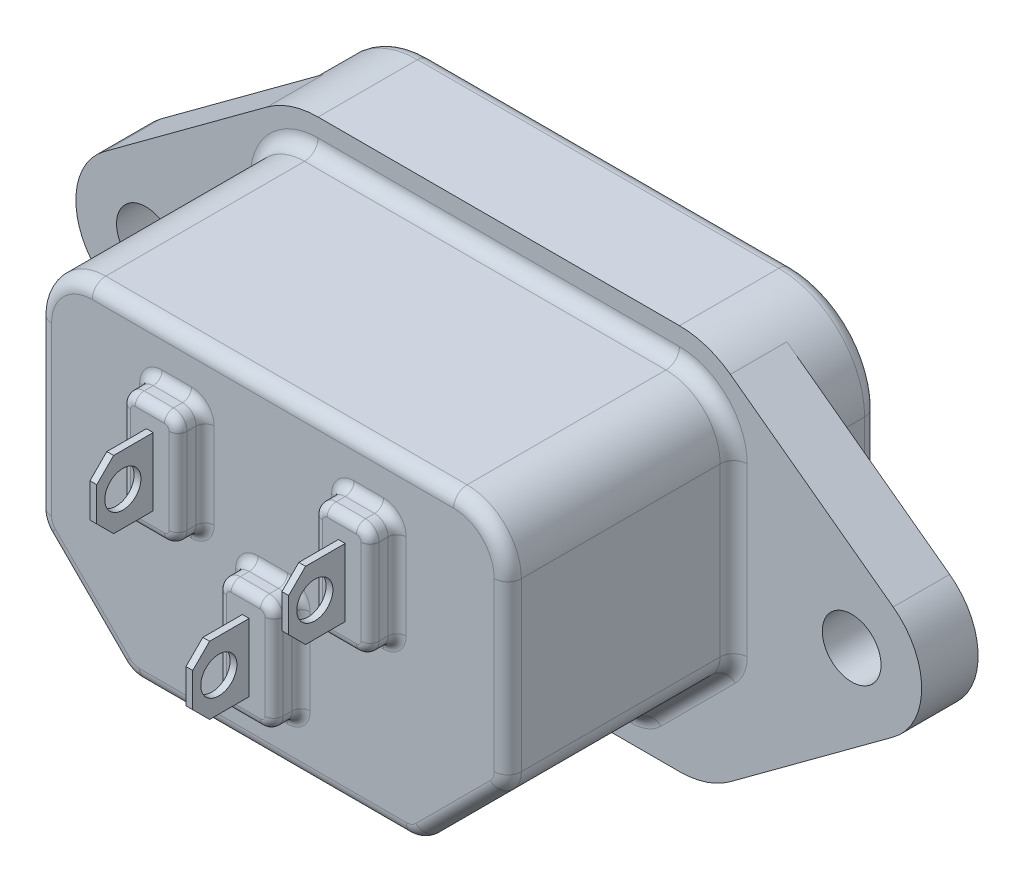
SolidWorks part; units mm, degrees
ref_plane "Front" through (0, 0, 0) normal (0, 0, 1) x (1, 0, 0)
ref_plane "Top" through (0, 0, 0) normal (0, 1, 0) x (1, 0, 0)
ref_plane "Side" through (0, 0, 0) normal (1, 0, 0) x (0, 0, -1)
sketch "Sketch1" plane through (0, 0, 0) normal (0, 0, 1) x (1, 0, 0)
  line L8 (-54.229, 34.671) -> (-33.909, 34.671)
  line L9 (-59.055, 17.78) -> (-59.055, 29.845)
  line L10 (-54.229, 12.954) -> (-33.909, 12.954)
  line L11 (-29.083, 17.78) -> (-29.083, 29.845)
  arc A8 (-54.229, 34.671) -> (-59.055, 29.845) centre (-54.229, 29.845) ccw
  arc A9 (-59.055, 17.78) -> (-54.229, 12.954) centre (-54.229, 17.78) ccw
  arc A10 (-33.909, 12.954) -> (-29.083, 17.78) centre (-33.909, 17.78) ccw
  arc A11 (-29.083, 29.845) -> (-33.909, 34.671) centre (-33.909, 29.845) ccw
extrude "Base-Extrude" add sketch "Sketch1" against normal blind 3.175
sketch "Sketch2" plane through (0, 0, 0) normal (0, 0, 1) x (1, 0, 0)
  line L2 (-54.229, 12.954) -> (-33.909, 12.954)
  line L3 (-54.229, 34.671) -> (-33.909, 34.671)
  line L4 (-57.0922, 33.7299) -> (-66.2485, 26.9818)
  line L5 (-66.2485, 20.6432) -> (-57.0922, 13.8951)
  line L6 (-31.0458, 13.8951) -> (-21.8895, 20.6432)
  line L7 (-31.0458, 33.7299) -> (-21.8895, 26.9818)
  arc A4 (-66.2485, 26.9818) -> (-66.2485, 20.6432) centre (-63.9128, 23.8125) ccw
  arc A5 (-21.8895, 20.6432) -> (-21.8895, 26.9818) centre (-24.2252, 23.8125) ccw
  circle A7 centre (-63.9128, 23.8125) radius 1.651
  circle A8 centre (-24.2252, 23.8125) radius 1.651
  arc A13 (-33.909, 12.954) -> (-31.0458, 13.8951) centre (-33.909, 17.78) ccw
  arc A14 (-57.0922, 13.8951) -> (-54.229, 12.954) centre (-54.229, 17.78) ccw
  arc A15 (-54.229, 34.671) -> (-57.0922, 33.7299) centre (-54.229, 29.845) ccw
  arc A16 (-31.0458, 33.7299) -> (-33.909, 34.671) centre (-33.909, 29.845) ccw
extrude "Boss-Extrude1" add sketch "Sketch2" along normal blind 3.175
sketch "Sketch3" plane through (0, 0, 3.175) normal (0, 0, 1) x (1, 0, 0)
  line L0 (-30.861, 19.812) -> (-35.941, 14.732)
  line L1 (-57.277, 19.812) -> (-52.197, 14.732)
  line L4 (-54.229, 32.893) -> (-33.909, 32.893)
  line L5 (-30.861, 29.845) -> (-30.861, 17.78)
  line L6 (-33.909, 14.732) -> (-54.229, 14.732)
  line L7 (-57.277, 17.78) -> (-57.277, 29.845)
  line L8 (-54.229, 32.893) -> (-33.909, 32.893)
  line L9 (-30.861, 29.845) -> (-30.861, 19.812)
  line L10 (-35.941, 14.732) -> (-52.197, 14.732)
  line L11 (-57.277, 19.812) -> (-57.277, 29.845)
  arc A4 (-54.229, 32.893) -> (-57.277, 29.845) centre (-54.229, 29.845) ccw
  arc A5 (-30.861, 29.845) -> (-33.909, 32.893) centre (-33.909, 29.845) ccw
  arc A6 (-33.909, 14.732) -> (-30.861, 17.78) centre (-33.909, 17.78) ccw
  arc A7 (-57.277, 17.78) -> (-54.229, 14.732) centre (-54.229, 17.78) ccw
  arc A8 (-54.229, 32.893) -> (-57.277, 29.845) centre (-54.229, 29.845) ccw
  arc A9 (-30.861, 29.845) -> (-33.909, 32.893) centre (-33.909, 29.845) ccw
  dimension "D2" = 45
  dimension "D3" = 45
  dimension "D4" = 5.08
  dimension "D1" = 1.778
extrude "Boss-Extrude2" add sketch "Sketch3" along normal blind 12.7
fillet "Fillet1" radius 1.524 4 edges at (-57.277, 19.812, 9.525) (-52.197, 14.732, 9.525) (-35.941, 14.732, 9.525) (-30.861, 19.812, 9.525)
fillet "Fillet2" radius 0.762 12 edges at (-56.3843, 32.0003, 3.175) (-31.7537, 32.0003, 3.175) (-44.069, 32.893, 3.175) (-30.861, 25.1441, 3.175) (-33.401, 17.272, 3.175) (-44.069, 14.732, 3.175) (-54.737, 17.272, 3.175) (-57.277, 25.1441, 3.175) (-30.977, 19.8601, 3.175) (-35.9891, 14.848, 3.175) (-52.1489, 14.848, 3.175) (-57.161, 19.8601, 3.175)
fillet "Fillet3" radius 0.762 20 edges at (-57.6415, 14.3675, -3.175) (-44.069, 12.954, -3.175) (-30.4965, 14.3675, -3.175) (-29.083, 23.8125, -3.175) (-30.4965, 33.2575, -3.175) (-44.069, 34.671, -3.175) (-57.6415, 33.2575, -3.175) (-30.861, 25.1441, 15.875) (-59.055, 23.8125, -3.175) (-44.069, 32.893, 15.875) (-56.3843, 32.0003, 15.875) (-31.7537, 32.0003, 15.875) (-33.401, 17.272, 15.875) (-57.277, 25.1441, 15.875) (-54.737, 17.272, 15.875) (-44.069, 14.732, 15.875) (-57.161, 19.8601, 15.875) (-52.1489, 14.848, 15.875) (-35.9891, 14.848, 15.875) (-30.977, 19.8601, 15.875)
sketch "Sketch4" plane through (0, 0, -3.175) normal (0, 0, -1) x (-1, 0, 0)
  line L6 (55.499, 20.5485) -> (51.4605, 16.51)
  line L7 (51.4605, 16.51) -> (36.6775, 16.51)
  line L8 (36.6775, 16.51) -> (32.639, 20.5485)
  line L9 (32.639, 20.5485) -> (32.639, 29.845)
  line L10 (33.909, 31.115) -> (54.229, 31.115)
  line L11 (55.499, 29.845) -> (55.499, 20.5485)
  line L12 (55.499, 20.5485) -> (51.4605, 16.51)
  line L13 (51.4605, 16.51) -> (36.6775, 16.51)
  line L14 (36.6775, 16.51) -> (32.639, 20.5485)
  line L15 (32.639, 20.5485) -> (32.639, 29.845)
  line L16 (33.909, 31.115) -> (54.229, 31.115)
  line L17 (55.499, 29.845) -> (55.499, 20.5485)
  arc A6 (33.909, 31.115) -> (32.639, 29.845) centre (33.909, 29.845) ccw
  arc A7 (55.499, 29.845) -> (54.229, 31.115) centre (54.229, 29.845) ccw
  arc A8 (33.909, 31.115) -> (32.639, 29.845) centre (33.909, 29.845) ccw
  arc A9 (55.499, 29.845) -> (54.229, 31.115) centre (54.229, 29.845) ccw
  dimension "D1" = 1.016
extrude "Cut-Extrude1" cut sketch "Sketch4" against normal blind 16.891
fillet "Fillet4" radius 0.762 12 edges at (-55.499, 20.5485, 5.2705) (-51.4605, 16.51, 5.2705) (-36.6775, 16.51, 5.2705) (-32.639, 20.5485, 5.2705) (-33.011, 30.743, 13.716) (-55.127, 30.743, 13.716) (-55.499, 25.1967, 13.716) (-53.4798, 18.5292, 13.716) (-44.069, 16.51, 13.716) (-34.6582, 18.5292, 13.716) (-32.639, 25.1967, 13.716) (-44.069, 31.115, 13.716)
fillet "Fillet5" radius 0.762 12 edges at (-55.499, 25.3546, -3.175) (-44.069, 31.115, -3.175) (-55.127, 30.743, -3.175) (-33.011, 30.743, -3.175) (-34.6582, 18.5292, -3.175) (-32.639, 25.3546, -3.175) (-44.069, 16.51, -3.175) (-53.4798, 18.5292, -3.175) (-32.697, 20.5725, -3.175) (-36.7015, 16.568, -3.175) (-51.4365, 16.568, -3.175) (-55.441, 20.5725, -3.175)
sketch "Sketch5" plane through (0, 0, 15.875) normal (0, 0, 1) x (1, 0, 0)
  line L0 (-44.069, 34.671) -> (-44.069, 12.954) construction
  line L2 (-50.292, 30.1625) -> (-48.641, 30.1625)
  line L3 (-51.054, 29.4005) -> (-51.054, 24.5745)
  line L4 (-48.641, 23.8125) -> (-50.292, 23.8125)
  line L5 (-47.879, 24.5745) -> (-47.879, 29.4005)
  line L6 (-37.846, 30.1625) -> (-39.497, 30.1625)
  line L7 (-37.084, 29.4005) -> (-37.084, 24.5745)
  line L8 (-39.497, 23.8125) -> (-37.846, 23.8125)
  line L9 (-40.259, 24.5745) -> (-40.259, 29.4005)
  line L10 (-43.2435, 23.8125) -> (-44.8945, 23.8125)
  line L11 (-45.6565, 23.0505) -> (-45.6565, 18.2245)
  line L12 (-42.4815, 23.0505) -> (-42.4815, 18.2245)
  line L13 (-44.8945, 17.4625) -> (-43.2435, 17.4625)
  line L15 (-54.229, 34.671) -> (-33.909, 34.671) construction
  line L16 (-54.229, 12.954) -> (-33.909, 12.954) construction
  arc A0 (-43.2435, 17.4625) -> (-42.4815, 18.2245) centre (-43.2435, 18.2245) ccw
  arc A1 (-44.8945, 17.4625) -> (-45.6565, 18.2245) centre (-44.8945, 18.2245) cw
  arc A2 (-43.2435, 23.8125) -> (-42.4815, 23.0505) centre (-43.2435, 23.0505) cw
  arc A3 (-45.6565, 23.0505) -> (-44.8945, 23.8125) centre (-44.8945, 23.0505) cw
  arc A4 (-47.879, 24.5745) -> (-48.641, 23.8125) centre (-48.641, 24.5745) cw
  arc A5 (-50.292, 23.8125) -> (-51.054, 24.5745) centre (-50.292, 24.5745) cw
  arc A6 (-47.879, 29.4005) -> (-48.641, 30.1625) centre (-48.641, 29.4005) ccw
  arc A7 (-51.054, 29.4005) -> (-50.292, 30.1625) centre (-50.292, 29.4005) cw
  arc A8 (-40.259, 24.5745) -> (-39.497, 23.8125) centre (-39.497, 24.5745) ccw
  arc A9 (-37.846, 23.8125) -> (-37.084, 24.5745) centre (-37.846, 24.5745) ccw
  arc A10 (-37.084, 29.4005) -> (-37.846, 30.1625) centre (-37.846, 29.4005) ccw
  arc A11 (-40.259, 29.4005) -> (-39.497, 30.1625) centre (-39.497, 29.4005) cw
  point P15 (-44.069, 23.8125)
  point P18 (-44.069, 17.2085)
  point P22 (-42.4815, 17.2085)
  point P27 (-42.4815, 23.8125)
  point P32 (-47.879, 23.8125)
  point P35 (-51.054, 23.8125)
  point P38 (-47.879, 28.8925)
  point P41 (-51.054, 28.8925)
  dimension "D3" = 0.762
  dimension "D1" = 3.175
  dimension "D2" = 6.35
extrude "Boss-Extrude3" add sketch "Sketch5" along normal blind 1.524
fillet "Fillet6" radius 0.508 48 edges at (-42.7047, 17.6857, 15.875) (-42.4815, 20.6375, 17.399) (-42.7047, 23.5893, 17.399) (-44.069, 23.8125, 15.875) (-45.4333, 23.5893, 17.399) (-45.6565, 20.6375, 15.875) (-45.4333, 17.6857, 17.399) (-44.069, 17.4625, 15.875) (-42.7047, 17.6857, 17.399) (-44.069, 23.8125, 17.399) (-45.6565, 20.6375, 17.399) (-44.069, 17.4625, 17.399) (-45.4333, 17.6857, 15.875) (-45.4333, 23.5893, 15.875) (-42.7047, 23.5893, 15.875) (-42.4815, 20.6375, 15.875) (-48.1022, 24.0357, 17.399) (-47.879, 26.9875, 15.875) (-48.1022, 29.9393, 15.875) (-49.4665, 30.1625, 17.399) (-50.8308, 29.9393, 17.399) (-51.054, 26.9875, 15.875) (-50.8308, 24.0357, 17.399) (-49.4665, 23.8125, 17.399) (-47.879, 26.9875, 17.399) (-48.1022, 29.9393, 17.399) (-51.054, 26.9875, 17.399) (-48.1022, 24.0357, 15.875) (-49.4665, 23.8125, 15.875) (-50.8308, 24.0357, 15.875) (-50.8308, 29.9393, 15.875) (-49.4665, 30.1625, 15.875) (-40.0358, 24.0357, 15.875) (-38.6715, 23.8125, 15.875) (-37.3072, 24.0357, 15.875) (-37.084, 26.9875, 17.399) (-37.3072, 29.9393, 15.875) (-38.6715, 30.1625, 15.875) (-40.0358, 29.9393, 17.399) (-40.259, 26.9875, 17.399) (-40.0358, 24.0357, 17.399) (-38.6715, 23.8125, 17.399) (-37.3072, 24.0357, 17.399) (-37.3072, 29.9393, 17.399) (-38.6715, 30.1625, 17.399) (-40.259, 26.9875, 15.875) (-40.0358, 29.9393, 15.875) (-37.084, 26.9875, 15.875)
sketch "Sketch6" plane through (0, 0, 17.399) normal (0, 0, 1) x (1, 0, 0)
  line L0 (-44.069, 34.671) -> (-44.069, 12.954) construction
  line L1 (-54.229, 34.671) -> (-33.909, 34.671) construction
  line L2 (-54.229, 12.954) -> (-33.909, 12.954) construction
  line L3 (-39.624, 28.8925) -> (-37.719, 28.8925)
  line L4 (-39.624, 28.8925) -> (-39.624, 25.0825)
  line L5 (-37.719, 25.0825) -> (-39.624, 25.0825)
  line L6 (-37.719, 25.0825) -> (-37.719, 28.8925)
  line L7 (-48.514, 28.8925) -> (-50.419, 28.8925)
  line L8 (-48.514, 28.8925) -> (-48.514, 25.0825)
  line L9 (-50.419, 25.0825) -> (-48.514, 25.0825)
  line L10 (-50.419, 25.0825) -> (-50.419, 28.8925)
  line L11 (-43.1165, 22.5425) -> (-45.0215, 22.5425)
  line L12 (-45.0215, 22.5425) -> (-45.0215, 18.7325)
  line L13 (-43.1165, 22.5425) -> (-43.1165, 18.7325)
  line L14 (-45.0215, 18.7325) -> (-43.1165, 18.7325)
  line L15 (-39.497, 30.1625) -> (-37.846, 30.1625) construction
  line L16 (-44.8945, 23.8125) -> (-43.2435, 23.8125) construction
  line L17 (-40.259, 24.5745) -> (-40.259, 29.4005) construction
  point P17 (-44.069, 22.5425)
  point P20 (-44.069, 18.7325)
  dimension "D1" = 3.81
  dimension "D2" = 1.905
  dimension "D3" = 1.27
  dimension "D4" = 1.27
  dimension "D5" = 0.635
extrude "Boss-Extrude4" add sketch "Sketch6" along normal blind 3.175 and the other way offset from surface (19.05 mm away) 1.524
sketch "Sketch7" plane through (0, 0, 20.574) normal (0, 0, 1) x (1, 0, 0)
  line L0 (-43.8785, 17.9705) -> (-43.2435, 17.9705)
  line L1 (-38.862, 28.8925) -> (-38.862, 25.0825)
  line L2 (-38.862, 29.6545) -> (-38.862, 24.3205)
  line L3 (-49.657, 25.0825) -> (-49.657, 28.8925)
  line L4 (-49.657, 24.3205) -> (-49.657, 29.6545)
  line L5 (-44.2595, 22.5425) -> (-44.2595, 18.7325)
  line L6 (-44.2595, 23.3045) -> (-44.2595, 17.9705)
  line L7 (-43.8785, 22.5425) -> (-43.8785, 18.7325)
  line L8 (-43.8785, 23.3045) -> (-43.8785, 17.9705)
  line L9 (-38.481, 25.0825) -> (-38.481, 28.8925)
  line L10 (-38.481, 24.3205) -> (-38.481, 29.6545)
  line L11 (-49.276, 28.8925) -> (-49.276, 25.0825)
  line L12 (-49.276, 29.6545) -> (-49.276, 24.3205)
  line L13 (-44.2595, 23.3045) -> (-44.8945, 23.3045)
  line L14 (-38.862, 29.6545) -> (-39.497, 29.6545)
  line L15 (-38.481, 24.3205) -> (-37.846, 24.3205)
  line L16 (-45.1485, 23.0505) -> (-45.1485, 18.2245)
  line L17 (-44.8945, 17.9705) -> (-43.2435, 17.9705)
  line L18 (-42.9895, 18.2245) -> (-42.9895, 23.0505)
  line L19 (-43.2435, 23.3045) -> (-44.8945, 23.3045)
  line L20 (-45.1485, 23.0505) -> (-45.1485, 18.2245)
  line L21 (-44.8945, 17.9705) -> (-44.2595, 17.9705)
  line L22 (-42.9895, 18.2245) -> (-42.9895, 23.0505)
  line L23 (-43.2435, 23.3045) -> (-43.8785, 23.3045)
  line L24 (-39.751, 29.4005) -> (-39.751, 24.5745)
  line L25 (-39.497, 24.3205) -> (-37.846, 24.3205)
  line L26 (-37.592, 24.5745) -> (-37.592, 29.4005)
  line L27 (-37.846, 29.6545) -> (-39.497, 29.6545)
  line L28 (-39.751, 29.4005) -> (-39.751, 24.5745)
  line L29 (-39.497, 24.3205) -> (-38.862, 24.3205)
  line L30 (-37.592, 24.5745) -> (-37.592, 29.4005)
  line L31 (-37.846, 29.6545) -> (-38.481, 29.6545)
  line L32 (-50.546, 29.4005) -> (-50.546, 24.5745)
  line L33 (-50.292, 24.3205) -> (-48.641, 24.3205)
  line L34 (-48.387, 24.5745) -> (-48.387, 29.4005)
  line L35 (-48.641, 29.6545) -> (-50.292, 29.6545)
  line L36 (-50.546, 29.4005) -> (-50.546, 24.5745)
  line L37 (-50.292, 24.3205) -> (-49.657, 24.3205)
  line L38 (-48.387, 24.5745) -> (-48.387, 29.4005)
  line L39 (-48.641, 29.6545) -> (-49.276, 29.6545)
  line L40 (-49.657, 29.6545) -> (-50.292, 29.6545)
  line L41 (-49.276, 24.3205) -> (-48.641, 24.3205)
  arc A4 (-44.8945, 23.3045) -> (-45.1485, 23.0505) centre (-44.8945, 23.0505) ccw
  arc A5 (-45.1485, 18.2245) -> (-44.8945, 17.9705) centre (-44.8945, 18.2245) ccw
  arc A6 (-43.2435, 17.9705) -> (-42.9895, 18.2245) centre (-43.2435, 18.2245) ccw
  arc A7 (-42.9895, 23.0505) -> (-43.2435, 23.3045) centre (-43.2435, 23.0505) ccw
  arc A8 (-44.8945, 23.3045) -> (-45.1485, 23.0505) centre (-44.8945, 23.0505) ccw
  arc A9 (-45.1485, 18.2245) -> (-44.8945, 17.9705) centre (-44.8945, 18.2245) ccw
  arc A10 (-43.2435, 17.9705) -> (-42.9895, 18.2245) centre (-43.2435, 18.2245) ccw
  arc A11 (-42.9895, 23.0505) -> (-43.2435, 23.3045) centre (-43.2435, 23.0505) ccw
  arc A12 (-39.497, 29.6545) -> (-39.751, 29.4005) centre (-39.497, 29.4005) ccw
  arc A13 (-39.751, 24.5745) -> (-39.497, 24.3205) centre (-39.497, 24.5745) ccw
  arc A14 (-37.846, 24.3205) -> (-37.592, 24.5745) centre (-37.846, 24.5745) ccw
  arc A15 (-37.592, 29.4005) -> (-37.846, 29.6545) centre (-37.846, 29.4005) ccw
  arc A16 (-39.497, 29.6545) -> (-39.751, 29.4005) centre (-39.497, 29.4005) ccw
  arc A17 (-39.751, 24.5745) -> (-39.497, 24.3205) centre (-39.497, 24.5745) ccw
  arc A18 (-37.846, 24.3205) -> (-37.592, 24.5745) centre (-37.846, 24.5745) ccw
  arc A19 (-37.592, 29.4005) -> (-37.846, 29.6545) centre (-37.846, 29.4005) ccw
  arc A20 (-50.292, 29.6545) -> (-50.546, 29.4005) centre (-50.292, 29.4005) ccw
  arc A21 (-50.546, 24.5745) -> (-50.292, 24.3205) centre (-50.292, 24.5745) ccw
  arc A22 (-48.641, 24.3205) -> (-48.387, 24.5745) centre (-48.641, 24.5745) ccw
  arc A23 (-48.387, 29.4005) -> (-48.641, 29.6545) centre (-48.641, 29.4005) ccw
  arc A24 (-50.292, 29.6545) -> (-50.546, 29.4005) centre (-50.292, 29.4005) ccw
  arc A25 (-50.546, 24.5745) -> (-50.292, 24.3205) centre (-50.292, 24.5745) ccw
  arc A26 (-48.641, 24.3205) -> (-48.387, 24.5745) centre (-48.641, 24.5745) ccw
  arc A27 (-48.387, 29.4005) -> (-48.641, 29.6545) centre (-48.641, 29.4005) ccw
  dimension "D1" = 0.762
  dimension "D2" = 0.762
  dimension "D3" = 0.762
  dimension "D4" = 0.762
  dimension "D5" = 0.762
  dimension "D6" = 0.762
  dimension "D7" = 0
  dimension "D8" = 0
  dimension "D9" = 0
extrude "Cut-Extrude2" cut sketch "Sketch7" against normal up to surface (3.175 mm away)
sketch "Sketch8" plane through (-38.481, 0, 0) normal (1, 0, 0) x (0, 0, -1)
  line L1 (-20.574, 28.8925) -> (-17.399, 28.8925) construction
  line L2 (-20.574, 22.5425) -> (-17.399, 22.5425) construction
  line L3 (-17.399, 24.3205) -> (-21.336, 24.3205)
  line L4 (-21.336, 24.3205) -> (-21.336, 29.6545)
  line L5 (-21.336, 29.6545) -> (-17.399, 29.6545)
  line L6 (-17.399, 24.3205) -> (-21.336, 24.3205)
  line L7 (-21.336, 24.3205) -> (-21.336, 29.6545)
  line L8 (-21.336, 29.6545) -> (-17.399, 29.6545)
  line L9 (-21.336, 23.3045) -> (-17.399, 23.3045)
  line L10 (-17.399, 17.9705) -> (-21.336, 17.9705)
  line L11 (-21.336, 23.3045) -> (-21.336, 17.9705)
  line L12 (-21.336, 23.3045) -> (-17.399, 23.3045)
  line L13 (-17.399, 17.9705) -> (-21.336, 17.9705)
  line L14 (-21.336, 23.3045) -> (-21.336, 17.9705)
  line L15 (-19.6259, 22.5425) -> (-17.399, 22.5425)
  line L16 (-20.574, 28.8925) -> (-20.574, 25.0825)
  line L17 (-20.574, 25.0825) -> (-17.399, 25.0825)
  line L18 (-17.399, 25.0825) -> (-17.399, 28.8925)
  line L19 (-17.399, 28.8925) -> (-20.574, 28.8925)
  line L20 (-17.399, 25.0825) -> (-20.574, 25.0825) construction
  line L21 (-19.6259, 25.0825) -> (-17.399, 25.0825)
  line L22 (-17.399, 18.7325) -> (-20.574, 18.7325) construction
  line L23 (-17.399, 28.8925) -> (-19.6259, 28.8925)
  line L24 (-17.399, 18.7325) -> (-19.6259, 18.7325)
  line L25 (-20.574, 25.0825) -> (-20.574, 28.8925) construction
  line L26 (-20.574, 22.5425) -> (-20.574, 18.7325) construction
  line L27 (-20.574, 26.0306) -> (-20.574, 27.9444)
  line L28 (-20.574, 21.5944) -> (-20.574, 19.6806)
  line L29 (-19.6259, 28.8925) -> (-20.574, 27.9444)
  line L30 (-20.574, 26.0306) -> (-19.6259, 25.0825)
  line L31 (-19.6259, 22.5425) -> (-20.574, 21.5944)
  line L32 (-20.574, 19.6806) -> (-19.6259, 18.7325)
  line L33 (-20.574, 26.9875) -> (-11.5559, 26.9875) construction
  line L34 (-20.574, 20.6375) -> (-10.3574, 20.6375) construction
  line L35 (-17.399, 28.8925) -> (-17.399, 29.6545)
  line L36 (-17.399, 25.0825) -> (-17.399, 24.3205)
  line L37 (-17.399, 23.3045) -> (-17.399, 22.5425)
  line L38 (-17.399, 18.7325) -> (-17.399, 17.9705)
  circle A0 centre (-19.1066, 26.9875) radius 1.016
  circle A1 centre (-19.1066, 20.6375) radius 1.016
  dimension "D9" = 2.032
  dimension "D10" = 1.4674
  dimension "D4" = 45
  dimension "D5" = 45
  dimension "D6" = 45
  dimension "D7" = 45
  dimension "D8" = 0.9481
  dimension "D1" = 0.762
  dimension "D2" = 0.762
  dimension "D3" = 0
extrude "Cut-Extrude3" cut sketch "Sketch8" against normal through all
sketch "Sketch9" plane through (0, 28.8925, 0) normal (0, 1, 0) x (-1, 0, 0)
  line L0 (38.6715, -1.651) -> (38.6715, -3.4299) construction
  line L1 (37.719, -1.651) -> (39.624, -1.651) construction
  line L2 (49.4665, -1.651) -> (49.4665, -3.4299) construction
  line L3 (50.419, -1.651) -> (48.514, -1.651) construction
  line L4 (50.8657, 0.8297) -> (50.6467, 0.8297)
  line L6 (50.6467, 0.8297) -> (49.4665, -2.413)
  line L7 (37.2723, 0.8297) -> (37.2723, -2.7869)
  line L8 (37.2723, -2.7869) -> (50.8657, -2.7869)
  line L9 (45.2492, 0.8297) -> (44.069, -2.413)
  line L10 (39.8517, 0.8297) -> (38.6715, -2.413)
  line L11 (50.8657, -2.7869) -> (50.8657, 0.8297)
  line L12 (37.4913, 0.8297) -> (38.6715, -2.413)
  line L13 (37.4913, 0.8297) -> (37.2723, 0.8297)
  line L14 (42.8888, 0.8297) -> (44.069, -2.413)
  line L15 (42.8888, 0.8297) -> (39.8517, 0.8297)
  line L16 (48.2863, 0.8297) -> (49.4665, -2.413)
  line L17 (44.069, 15.113) -> (44.069, -9.2844) construction
  line L18 (48.2863, 0.8297) -> (45.2492, 0.8297)
  line L19 (45.0215, 13.716) -> (45.0215, -1.651) construction
  line L20 (43.1165, 13.716) -> (43.1165, -1.651) construction
  line L21 (33.909, -2.413) -> (54.229, -2.413) construction
  line L22 (54.229, 15.113) -> (33.909, 15.113) construction
  line L23 (45.0215, -1.651) -> (43.1165, -1.651) construction
  dimension "D1" = 20
  dimension "D2" = 20
  dimension "D3" = 2.4807
  dimension "D4" = 3.6166
  dimension "D5" = 13.5934
  dimension "D6" = 6.7967
extrude "Cut-Extrude4" cut sketch "Sketch9" against normal up to surface (10.16 mm away)
